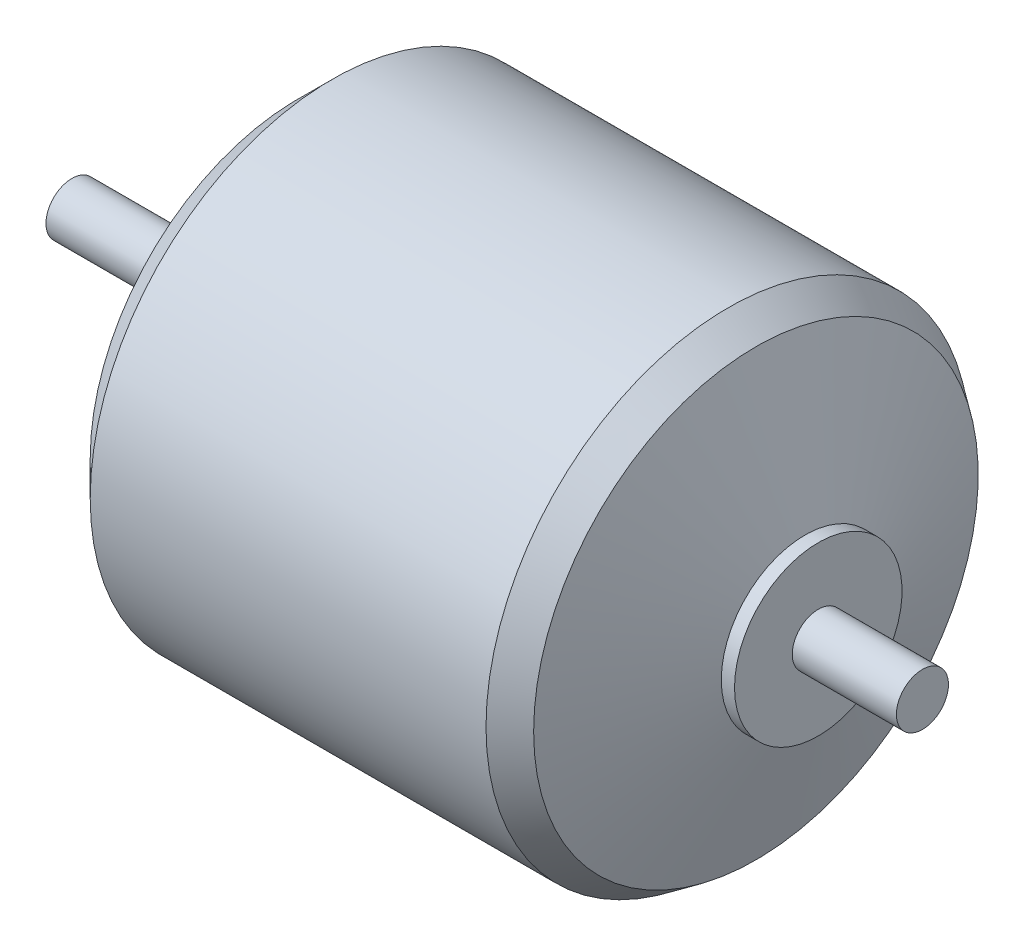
SolidWorks part; units mm, degrees
ref_plane "Front Plane" through (0, 0, 0) normal (0, 0, 1) x (1, 0, 0)
ref_plane "Top Plane" through (0, 0, 0) normal (0, 1, 0) x (1, 0, 0)
ref_plane "Right Plane" through (0, 0, 0) normal (1, 0, 0) x (0, 0, -1)
sketch "Sketch1" plane through (0, 0, 0) normal (1, 0, 0) x (0, 0, -1)
  circle A0 centre (0, 0) radius 13.95
  dimension "D1" = 27.9
extrude "Boss-Extrude1" add sketch "Sketch1" along normal blind 30
sketch "Sketch2" plane through (30, 0, 0) normal (1, 0, 0) x (0, 0, -1)
  circle A0 centre (0, 0) radius 1.5
  dimension "D1" = 3
extrude "Boss-Extrude2" add sketch "Sketch2" along normal blind 6
sketch "Sketch3" plane through (0, 0, 0) normal (-1, 0, 0) x (0, 0, 1)
  circle A0 centre (0, 0) radius 1.5
  dimension "D1" = 3
extrude "Boss-Extrude3" add sketch "Sketch3" along normal blind 13
sketch "Sketch4" plane through (0, 0, 0) normal (-1, 0, 0) x (0, 0, 1)
  line L0 (-12.2864, 0) -> (12.5578, 0) construction
  line L1 (0, 13.2726) -> (0, -11.1193) construction
  circle A0 centre (-9.5, 0) radius 1.5
  circle A1 centre (9.5, 0) radius 1.5
  circle A2 centre (0, 9.5) radius 1.5
  circle A3 centre (0, -9.5) radius 1.5
  point P13 (0, 0)
  point P14 (0, 0)
  point P15 (0, 0)
  point P16 (0, 0)
  point P17 (0, 0)
  point P18 (0, 0)
  point P19 (0, 0)
  dimension "D3" = 3
  dimension "D4" = 3
  dimension "D5" = 3
  dimension "D6" = 3
  dimension "D1" = 19
  dimension "D2" = 19
extrude "Cut-Extrude1" cut sketch "Sketch4" against normal blind 4
sketch "Sketch5" plane through (0, 0, 0) normal (0, 0, 1) x (1, 0, 0)
  line L0 (0, 11.95) -> (2, 13.95)
  line L1 (0, 13.95) -> (0, -13.95) construction
  line L2 (2, 13.95) -> (0, 13.95)
  line L3 (0, 13.95) -> (0, 11.95)
  line L4 (30, 13.95) -> (0, 13.95) construction
  line L5 (30, 4.8264) -> (29.2381, 4.8264)
  line L6 (30, -13.95) -> (30, 13.95) construction
  line L7 (29.2381, 4.8264) -> (26.4071, 12.8079)
  line L8 (26.4071, 12.8079) -> (24.8039, 13.95)
  line L9 (24.8039, 13.95) -> (30, 13.95)
  line L10 (30, 13.95) -> (30, 4.8264)
  line L11 (-14.2547, 0) -> (38.6797, 0) construction
  dimension "D1" = 45
  dimension "D2" = 2
  dimension "D3" = 35.466
  dimension "D4" = 109.53
revolve "Cut-Revolve1" cut sketch "Sketch5" angle 360 about L11
sketch "Sketch7" plane through (0, 0, 0) normal (-1, 0, 0) x (0, 0, 1)
  circle A0 centre (0, 0) radius 3.5
  dimension "D1" = 7
extrude "Boss-Extrude4" add sketch "Sketch7" along normal blind 4
